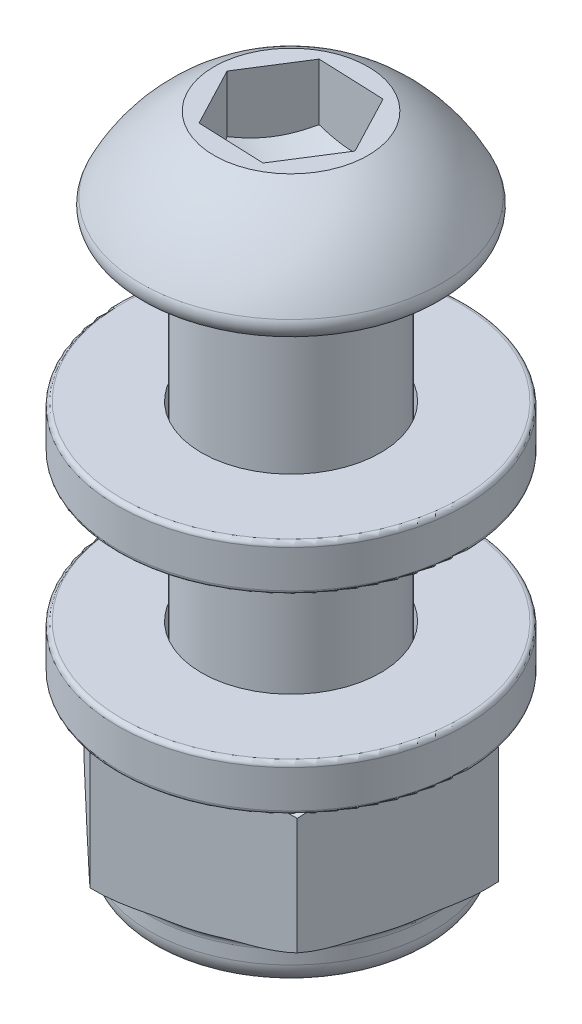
SolidWorks part; units mm, degrees
ref_plane "Plan de face" through (0, 0, 0) normal (0, 0, 1) x (1, 0, 0)
ref_plane "Plan de dessus" through (0, 0, 0) normal (0, 1, 0) x (1, 0, 0)
ref_plane "Plan de droite" through (0, 0, 0) normal (1, 0, 0) x (0, 0, -1)
sketch "Esquisse1" plane through (0, 0, 0) normal (0, 0, 1) x (1, 0, 0)
  line L0 (0, 0) -> (0, -20)
  line L1 (0, -20) -> (-2.4, -20)
  line L2 (-2.4, -20) -> (-3, -19.4)
  line L3 (-3, -19.4) -> (-3, 0)
  line L4 (-2.5, 3.3) -> (-2.6658, 3.3)
  line L6 (-2.5, 3.3) -> (-2.5, 1.4434)
  line L7 (-2.5, 1.4434) -> (0, 0)
  line L8 (-4.75, 0) -> (-3, 0)
  arc A0 (-2.6658, 3.3) -> (-5.1981, 0.7218) centre (0, -1.8511) ccw
  arc A1 (-5.1981, 0.7218) -> (-4.75, 0) centre (-4.75, 0.5) ccw
  dimension "D5" = 3.3
  dimension "D7" = 5.8
  dimension "D3" = 0.5
  dimension "D1" = 60
  dimension "D2" = 3
  dimension "D4" = 2.5
  dimension "D6" = 4.75
  dimension "D8" = 45
  dimension "D9" = 0.6
  dimension "D10" = 3.3
  dimension "D11" = 20
revolve "Révolution1" add sketch "Esquisse1" angle 360 about L0
sketch "Esquisse2" plane through (0, 3.3, 0) normal (0, 1, 0) x (1, 0, 0)
  line L1 (-1.0737, 2.0446) -> (-2.3075, 0.0925)
  line L2 (-2.3075, 0.0925) -> (-1.2339, -1.9521)
  line L3 (-1.2339, -1.9521) -> (1.0737, -2.0446)
  line L4 (1.0737, -2.0446) -> (2.3075, -0.0925)
  line L5 (2.3075, -0.0925) -> (1.2339, 1.9521)
  line L6 (1.2339, 1.9521) -> (-1.0737, 2.0446)
  circle A0 centre (0, 0) radius 2 construction
  circle A1 centre (0, 0) radius 2.6658 construction
  circle A2 centre (0, 0) radius 2.6658
  dimension "D2" = 4
extrude "Boss.-Extru.1" add sketch "Esquisse2" against normal up to surface (3.3 mm away)
sketch "Esquisse4" plane through (0, 0, 0) normal (0, 0, 1) x (1, 0, 0)
  line L0 (0, 0) -> (0, -18.2878) construction
  line L1 (3.1, -12) -> (5.85, -12)
  line L2 (3.1, -12) -> (3.1, -13.6)
  line L3 (3.1, -13.6) -> (5.85, -13.6)
  line L4 (6, -12.15) -> (6, -13.45)
  arc A0 (5.85, -13.6) -> (6, -13.45) centre (5.85, -13.45) ccw
  arc A1 (5.85, -12) -> (6, -12.15) centre (5.85, -12.15) cw
  dimension "D4" = 0.15
  dimension "D1" = 3.1
  dimension "D2" = 1.6
  dimension "D3" = 6
  dimension "D5" = 12
revolve "Révolution2" add sketch "Esquisse4" angle 360 about L0
sketch "Esquisse3" plane through (0, 0, 0) normal (0, 0, 1) x (1, 0, 0)
  line L0 (3, -19.4) -> (3, 0) construction
  line L1 (3.25, -13.6) -> (5, -13.6)
  line L2 (3, -13.85) -> (3, -19.4)
  line L3 (0, 0) -> (0, -17.1274) construction
  line L4 (5, -13.6) -> (5, -18.1) construction
  line L5 (3.75, -19.6) -> (3.75, -19.4)
  line L6 (3, -13.85) -> (3.25, -13.6)
  line L7 (4.9, -18.3879) -> (4.9, -18.85)
  line L8 (4.15, -19.6) -> (3.75, -19.6)
  line L9 (-5.85, -13.6) -> (5.85, -13.6) construction
  line L10 (3.75, -19.4) -> (3, -19.4)
  line L11 (6.75, -15.85) -> (5, -15.85) construction
  line L12 (5, -15.85) -> (3.25, -15.85) construction
  arc A0 (4.9, -18.3879) -> (5.164, -18.0901) centre (5.2, -18.3879) cw
  arc A1 (4.9, -18.85) -> (4.15, -19.6) centre (4.15, -18.85) cw
  ellipse E0 centre (5, -15.85) end of major axis (5, -13.6) minor radius 1.75 (5.164, -18.0901) -> (5, -13.6) ccw
  point P0 (3, -13.6)
  point P15 (4.9, -19.6)
  dimension "D6" = 0.75
  dimension "D7" = 1.9
  dimension "D8" = 0.3
  dimension "D1" = 4.5
  dimension "D2" = 6
  dimension "D3" = 5
  dimension "D4" = 5.8
  dimension "D5" = 0.75
  dimension "D10" = 1.75
revolve "Révolution3" add sketch "Esquisse3" angle 360 about L3
sketch "Esquisse5" plane through (0, -12, 0) normal (0, 1, 0) x (1, 0, 0)
  line L1 (-5.5357, -1.6398) -> (-1.3478, -5.614)
  line L2 (-1.3478, -5.614) -> (4.188, -3.9742)
  line L3 (4.188, -3.9742) -> (5.5357, 1.6398)
  line L4 (5.5357, 1.6398) -> (1.3478, 5.614)
  line L5 (1.3478, 5.614) -> (-4.188, 3.9742)
  line L6 (-4.188, 3.9742) -> (-5.5357, -1.6398)
  circle A0 centre (0, 0) radius 5 construction
  circle A1 centre (0, 0) radius 9.7979
  dimension "D1" = 10
extrude "Enlèv. mat.-Extru.1" cut sketch "Esquisse5" against normal blind 10
pattern_linear "Répétition linéaire1" count 2 spacing 6.6 along (0, 1, 0)
fillet "Congé1" radius 0.5 1 edges at (0, -19.6, 3.75)
